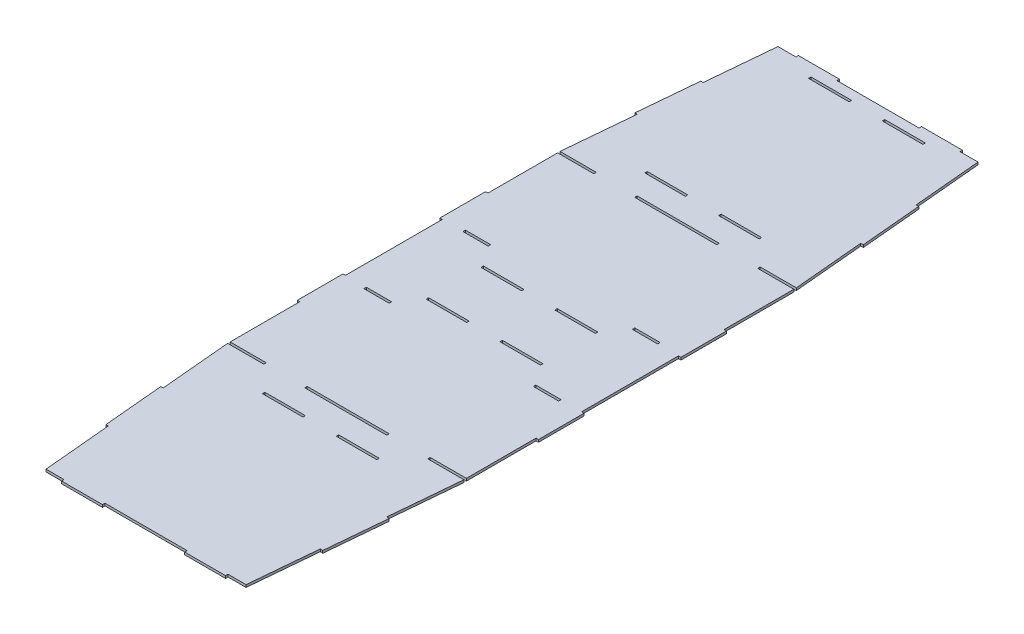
SolidWorks part; units mm, degrees
ref_plane "Front Plane" through (0, 0, 0) normal (0, 0, 1) x (1, 0, 0)
ref_plane "Top Plane" through (0, 0, 0) normal (0, 1, 0) x (1, 0, 0)
ref_plane "Right Plane" through (0, 0, 0) normal (1, 0, 0) x (0, 0, -1)
sketch "Sketch1" plane through (0, 0, 0) normal (0, 1, 0) x (1, 0, 0)
  line L0 (61.9912, 0) -> (50.7964, 0)
  line L1 (-0.0728, 328.676) -> (-0.0728, 220.7074) construction
  line L2 (50.7964, 0) -> (50.7964, -1.524)
  line L3 (50.7964, -1.524) -> (25.3964, -1.524)
  line L4 (25.3964, -1.524) -> (25.3964, 0)
  line L5 (25.3964, 0) -> (-25.5419, 0)
  line L6 (-25.5419, 0) -> (-25.5419, -1.524)
  line L7 (-35.5427, 243.3388) -> (-10.3967, 243.3388)
  line L8 (-25.5419, -1.524) -> (-50.9419, -1.524)
  line L9 (-35.5427, 243.3388) -> (-35.5427, 244.8628)
  line L10 (-50.9419, -1.524) -> (-50.9419, 0)
  line L11 (-35.5427, 244.8628) -> (-10.3967, 244.8628)
  line L12 (-50.9419, 0) -> (-62.1368, 0)
  line L13 (61.9912, 0) -> (65.8314, 42.3039)
  line L14 (65.8314, 42.3039) -> (67.4168, 42.16)
  line L15 (67.4168, 42.16) -> (70.8483, 79.9611)
  line L16 (70.8483, 79.9611) -> (69.2629, 80.105)
  line L17 (69.2629, 80.105) -> (73.2149, 123.9529)
  line L18 (73.2149, 123.9529) -> (50.7964, 123.952)
  line L19 (50.7964, 123.952) -> (50.7964, 125.476)
  line L20 (25.3964, 125.476) -> (-25.5419, 125.476)
  line L21 (25.3964, 125.476) -> (25.3964, 123.952)
  line L22 (25.3964, 123.952) -> (-25.5419, 123.952)
  line L23 (-25.5419, 123.952) -> (-25.5419, 125.476)
  line L24 (-50.9419, 125.476) -> (-73.3605, 125.476)
  line L25 (-50.9419, 125.476) -> (-50.9419, 123.952)
  line L26 (-50.9419, 123.952) -> (-73.3836, 123.952)
  line L27 (-73.3836, 123.952) -> (-69.4046, 80.0999)
  line L28 (-70.8707, 79.9495) -> (-69.4046, 80.0999)
  line L29 (-70.8707, 79.9495) -> (-67.4803, 42.4277)
  line L30 (-67.4803, 42.4277) -> (-66.0004, 42.5809)
  line L31 (-66.0004, 42.5809) -> (-62.1368, 0)
  line L32 (73.2149, 227.076) -> (214.4051, 227.076) construction
  line L33 (73.2149, 125.476) -> (50.7964, 125.476)
  line L34 (73.2149, 125.476) -> (73.2149, 168.7113)
  line L35 (-0.0728, 123.952) -> (-0.0728, -171.123) construction
  line L36 (-73.3605, 285.4407) -> (-73.3605, 328.676)
  line L37 (73.2149, 328.676) -> (50.7964, 328.676)
  line L38 (-66.0004, 411.5711) -> (-62.1368, 454.152)
  line L39 (-67.4803, 411.7243) -> (-66.0004, 411.5711)
  line L40 (-70.8707, 374.2025) -> (-67.4803, 411.7243)
  line L41 (-70.8707, 374.2025) -> (-69.4046, 374.0521)
  line L42 (-73.3836, 330.2) -> (-69.4046, 374.0521)
  line L43 (-50.9419, 330.2) -> (-73.3836, 330.2)
  line L44 (-50.9419, 328.676) -> (-50.9419, 330.2)
  line L45 (-50.9419, 328.676) -> (-73.3605, 328.676)
  line L46 (-25.5419, 330.2) -> (-25.5419, 328.676)
  line L47 (25.3964, 330.2) -> (-25.5419, 330.2)
  line L48 (25.3964, 328.676) -> (25.3964, 330.2)
  line L49 (25.3964, 328.676) -> (-25.5419, 328.676)
  line L50 (50.7964, 330.2) -> (50.7964, 328.676)
  line L51 (73.2149, 330.1991) -> (50.7964, 330.2)
  line L52 (69.2629, 374.047) -> (73.2149, 330.1991)
  line L53 (70.8483, 374.1909) -> (69.2629, 374.047)
  line L54 (67.4168, 411.992) -> (70.8483, 374.1909)
  line L55 (65.8314, 411.8481) -> (67.4168, 411.992)
  line L56 (61.9912, 454.152) -> (65.8314, 411.8481)
  line L57 (-50.9419, 454.152) -> (-62.1368, 454.152)
  line L58 (-50.9419, 455.676) -> (-50.9419, 454.152)
  line L59 (-25.5419, 455.676) -> (-50.9419, 455.676)
  line L60 (-25.5419, 454.152) -> (-25.5419, 455.676)
  line L61 (25.3964, 454.152) -> (-25.5419, 454.152)
  line L62 (25.3964, 455.676) -> (25.3964, 454.152)
  line L63 (50.7964, 455.676) -> (25.3964, 455.676)
  line L64 (50.7964, 454.152) -> (50.7964, 455.676)
  line L65 (61.9912, 454.152) -> (50.7964, 454.152)
  line L66 (73.2149, 197.0629) -> (73.2149, 257.0891)
  line L67 (73.2149, 197.0629) -> (74.7389, 197.0629)
  line L68 (74.7389, 257.0891) -> (74.7389, 285.4407)
  line L69 (73.2149, 168.7113) -> (74.7389, 168.7113)
  line L70 (74.7389, 197.0629) -> (74.7389, 168.7113)
  line L71 (73.2149, 285.4407) -> (74.7389, 285.4407)
  line L72 (73.2149, 257.0891) -> (74.7389, 257.0891)
  line L73 (73.2149, 285.4407) -> (73.2149, 328.676)
  line L74 (-73.3605, 257.0891) -> (-74.8845, 257.0891)
  line L75 (-73.3605, 285.4407) -> (-74.8845, 285.4407)
  line L76 (-74.8845, 197.0629) -> (-74.8845, 168.7113)
  line L77 (-73.3605, 168.7113) -> (-74.8845, 168.7113)
  line L78 (-74.8845, 257.0891) -> (-74.8845, 285.4407)
  line L79 (-73.3605, 197.0629) -> (-74.8845, 197.0629)
  line L80 (-73.3605, 197.0629) -> (-73.3605, 257.0891)
  line L81 (-73.3605, 125.476) -> (-73.3605, 168.7113)
  line L82 (-10.3967, 243.3388) -> (-10.3967, 244.8628)
  line L83 (10.2512, 243.3388) -> (10.2512, 244.8628)
  line L84 (35.3972, 244.8628) -> (10.2512, 244.8628)
  line L85 (35.3972, 243.3388) -> (35.3972, 244.8628)
  line L86 (35.3972, 243.3388) -> (10.2512, 243.3388)
  line L87 (35.3972, 210.8132) -> (10.2512, 210.8132)
  line L88 (35.3972, 210.8132) -> (35.3972, 209.2892)
  line L89 (35.3972, 209.2892) -> (10.2512, 209.2892)
  line L90 (10.2512, 210.8132) -> (10.2512, 209.2892)
  line L91 (-10.3967, 210.8132) -> (-10.3967, 209.2892)
  line L92 (-35.5427, 209.2892) -> (-10.3967, 209.2892)
  line L93 (-35.5427, 210.8132) -> (-35.5427, 209.2892)
  line L94 (-35.5427, 210.8132) -> (-10.3967, 210.8132)
  line L95 (-35.5427, 344.9388) -> (-10.3967, 344.9388)
  line L96 (-35.5427, 344.9388) -> (-35.5427, 346.4628)
  line L97 (-35.5427, 346.4628) -> (-10.3967, 346.4628)
  line L98 (-10.3967, 344.9388) -> (-10.3967, 346.4628)
  line L99 (10.2512, 344.9388) -> (10.2512, 346.4628)
  line L100 (35.3972, 346.4628) -> (10.2512, 346.4628)
  line L101 (35.3972, 344.9388) -> (35.3972, 346.4628)
  line L102 (35.3972, 344.9388) -> (10.2512, 344.9388)
  line L103 (-35.5427, 446.5388) -> (-10.3967, 446.5388)
  line L104 (-35.5427, 446.5388) -> (-35.5427, 448.0628)
  line L105 (-35.5427, 448.0628) -> (-10.3967, 448.0628)
  line L106 (-10.3967, 446.5388) -> (-10.3967, 448.0628)
  line L107 (10.2512, 446.5388) -> (10.2512, 448.0628)
  line L108 (35.3972, 448.0628) -> (10.2512, 448.0628)
  line L109 (35.3972, 446.5388) -> (35.3972, 448.0628)
  line L110 (35.3972, 446.5388) -> (10.2512, 446.5388)
  line L119 (35.3972, 109.2132) -> (10.2512, 109.2132)
  line L120 (35.3972, 109.2132) -> (35.3972, 107.6892)
  line L121 (35.3972, 107.6892) -> (10.2512, 107.6892)
  line L122 (10.2512, 109.2132) -> (10.2512, 107.6892)
  line L123 (-10.3967, 109.2132) -> (-10.3967, 107.6892)
  line L124 (-35.5427, 107.6892) -> (-10.3967, 107.6892)
  line L125 (-35.5427, 109.2132) -> (-35.5427, 107.6892)
  line L126 (-35.5427, 109.2132) -> (-10.3967, 109.2132)
  dimension "D1" = 3
extrude "Boss-Extrude1" add sketch "Sketch1" along normal blind 1.524
sketch "Sketch2" plane through (0, 0, 0) normal (0, -1, 0) x (-1, 0, 0)
  line L0 (-74.7389, 227.076) -> (-152.6244, 227.076) construction
  line L1 (-60.3267, 197.1335) -> (-44.6498, 197.1335)
  line L2 (-60.3267, 197.1335) -> (-60.3267, 195.6095)
  line L3 (-60.3267, 195.6095) -> (-44.6498, 195.6095)
  line L4 (-44.6498, 197.1335) -> (-44.6498, 195.6095)
  line L6 (-44.6498, 257.0185) -> (-44.6498, 258.5425)
  line L7 (-60.3267, 258.5425) -> (-44.6498, 258.5425)
  line L8 (-60.3267, 257.0185) -> (-60.3267, 258.5425)
  line L9 (-60.3267, 257.0185) -> (-44.6498, 257.0185)
  line L10 (0.0728, 125.476) -> (0.0728, 328.676) construction
  line L13 (60.4722, 257.0185) -> (44.7953, 257.0185)
  line L14 (60.4722, 257.0185) -> (60.4722, 258.5425)
  line L15 (60.4722, 258.5425) -> (44.7953, 258.5425)
  line L16 (44.7953, 257.0185) -> (44.7953, 258.5425)
  line L17 (44.7953, 197.1335) -> (44.7953, 195.6095)
  line L18 (60.4722, 195.6095) -> (44.7953, 195.6095)
  line L19 (60.4722, 197.1335) -> (60.4722, 195.6095)
  line L20 (60.4722, 197.1335) -> (44.7953, 197.1335)
extrude "Cut-Extrude1" cut sketch "Sketch2" against normal blind 1.524
